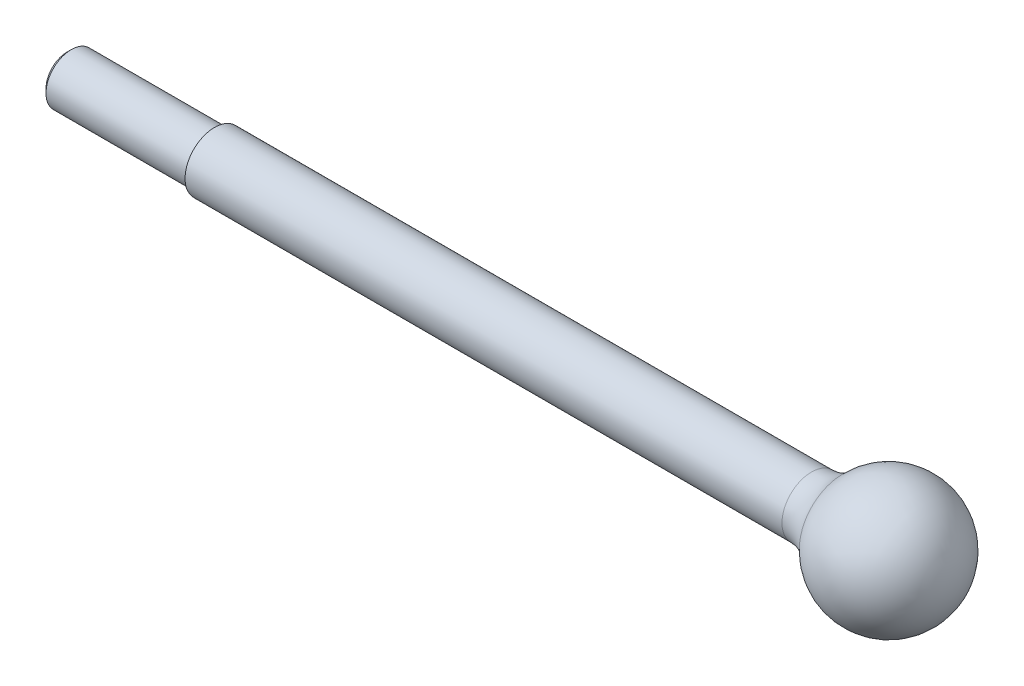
SolidWorks part; units mm, degrees
ref_plane "Front Plane" through (0, 0, 0) normal (0, 0, 1) x (1, 0, 0)
ref_plane "Top Plane" through (0, 0, 0) normal (0, 1, 0) x (1, 0, 0)
ref_plane "Right Plane" through (0, 0, 0) normal (1, 0, 0) x (0, 0, -1)
sketch "Sketch1" plane through (0, 0, 0) normal (0, 1, 0) x (1, 0, 0)
  line L0 (15, 0) -> (-195, 0)
  line L1 (-195, 0) -> (-195, 6)
  line L2 (-195, 6) -> (-160, 6)
  line L3 (-160, 6) -> (-160, 7)
  line L4 (-160, 7) -> (-13.2665, 7)
  arc A0 (15, 0) -> (-13.2665, 7) centre (0, 0) ccw
  dimension "D1" = 15
  dimension "D2" = 6
  dimension "D3" = 7
  dimension "D4" = 35
  dimension "D5" = 210
revolve "Revolve1" add sketch "Sketch1" angle 360 about L0
fillet "Fillet1" radius 10 1 edges at (-13.2665, 0, -7)
chamfer "Chamfer1" distance 1 angle 45 1 edges at (-195, 0, -6)
